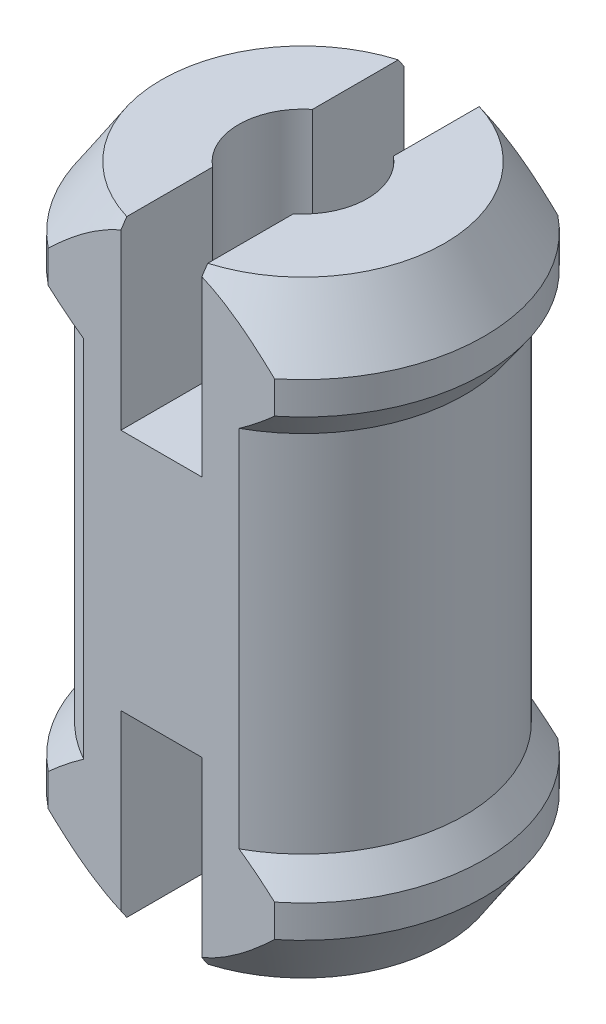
SolidWorks part; units mm, degrees
ref_plane "Front Plane" through (0, 0, 0) normal (0, 0, 1) x (1, 0, 0)
ref_plane "Top Plane" through (0, 0, 0) normal (0, 1, 0) x (1, 0, 0)
ref_plane "Right Plane" through (0, 0, 0) normal (1, 0, 0) x (0, 0, -1)
sketch "Sketch2" plane through (0, 0, 0) normal (1, 0, 0) x (0, 0, -1)
  line L0 (-17.036, 16) -> (-18.947, 16)
  line L1 (-18.947, 16) -> (-18.947, 11.5)
  line L2 (-18.947, 11.5) -> (-20.536, 11.5)
  line L3 (-20.536, 11.5) -> (-20.536, 8.5)
  line L4 (-20.536, 8.5) -> (-16.5442, 8.5)
  line L5 (-16.5442, 8.5) -> (-16.5442, 13)
  line L6 (-16.5442, 13) -> (-16.0559, 13.7)
  line L7 (-16.0559, 13.7) -> (-16.0559, 14.5)
  line L8 (-16.0559, 14.5) -> (-17.036, 16)
  dimension "D1" = 3.9917
  dimension "D2" = 1.911
  dimension "D3" = 4.5
  dimension "D4" = 4.5
  dimension "D5" = 0.8
  dimension "D6" = 1.5
  dimension "D7" = 0.7
  dimension "D8" = 4.4801
  dimension "D9" = 3.5
revolve "Revolve1" add sketch "Sketch2" angle 360 about L3
sketch "Sketch4" plane through (0, 16, 0) normal (0, 1, 0) x (1, 0, 0)
  line L0 (0, -14.676) -> (0, -33.3859) construction
  line L1 (-1, -14.676) -> (-1, -33.3859)
  line L2 (1, -14.676) -> (1, -33.3859)
  arc A0 (-1, -14.676) -> (1, -14.676) centre (0, -14.676) cw
  arc A1 (-1, -33.3859) -> (1, -33.3859) centre (0, -33.3859) ccw
  dimension "D1" = 1
  dimension "D2" = 1
extrude "Cut-Extrude2" cut sketch "Sketch4" against normal blind 4.5
sketch "Sketch5" plane through (0, 16, 0) normal (0, 1, 0) x (1, 0, 0)
  line L0 (0, -20.536) -> (-6.3318, -20.536) construction
  line L1 (0, -20.536) -> (7.4758, -20.536) construction
  line L2 (0, -17.036) -> (7.4758, -17.036)
  line L3 (0, -17.036) -> (-6.3318, -17.036)
  line L4 (0, -24.036) -> (7.4758, -24.036)
  line L5 (0, -24.036) -> (-6.3318, -24.036)
  line L6 (-1, -24.903) -> (-1, -23.8901) construction
  line L7 (-1, -17.1819) -> (-1, -16.169) construction
  line L8 (1, -16.169) -> (1, -17.1819) construction
  line L9 (1, -23.8901) -> (1, -24.903) construction
  line L10 (-1, -24.036) -> (-1, -23.8901)
  line L11 (-1, -17.1819) -> (-1, -17.036)
  line L12 (1, -17.036) -> (1, -17.1819)
  line L13 (1, -23.8901) -> (1, -24.036)
  line L15 (-6.3318, -17.036) -> (7.4758, -17.036)
  line L16 (-6.3318, -17.036) -> (-6.3318, -13.7773)
  line L17 (-6.3318, -13.7773) -> (7.4758, -13.7773)
  line L18 (7.4758, -17.036) -> (7.4758, -13.7773)
  line L19 (7.4758, -24.036) -> (-6.5355, -24.036)
  line L20 (7.4758, -24.036) -> (7.4758, -26.0597)
  line L21 (7.4758, -26.0597) -> (-6.5355, -26.0597)
  line L22 (-6.5355, -24.036) -> (-6.5355, -26.0597)
  arc A0 (7.4758, -17.036) -> (7.4758, -24.036) centre (7.4758, -20.536) cw
  arc A1 (-6.3318, -17.036) -> (-6.3318, -24.036) centre (-6.3318, -20.536) ccw
  arc A2 (-1, -16.169) -> (-1, -24.903) centre (0, -20.536) ccw construction
  arc A3 (-1, -17.1819) -> (-1, -23.8901) centre (0, -20.536) ccw construction
  arc A4 (1, -24.903) -> (1, -16.169) centre (0, -20.536) ccw construction
  arc A5 (1, -23.8901) -> (1, -17.1819) centre (0, -20.536) ccw construction
  arc A6 (-2.7966, -17.036) -> (-2.7966, -24.036) centre (0, -20.536) ccw
  arc A7 (-1, -17.1819) -> (-1, -23.8901) centre (0, -20.536) ccw
  arc A8 (2.7966, -24.036) -> (2.7966, -17.036) centre (0, -20.536) ccw
  arc A9 (1, -23.8901) -> (1, -17.1819) centre (0, -20.536) ccw
  dimension "D1" = 3.5
  dimension "D2" = 3.5
extrude "Cut-Extrude4" cut sketch "Sketch5" against normal through all contours L2 L15 L18 L17 L16 L3 | L19 L22 L21 L20 L4 L5 L11
mirror "Mirror4" about plane through (0, 8.5, 20.536) normal (0, 1, 0) of "Revolve1", "Cut-Extrude4"
sketch "Sketch7" plane through (0, 1, 0) normal (0, -1, 0) x (1, 0, 0)
  line L0 (0, 20.536) -> (0, 26.3334) construction
  line L1 (0, 26.3334) -> (0, 10.9386) construction
  line L2 (-1, 26.3334) -> (-1, 10.9386)
  line L3 (1, 26.3334) -> (1, 10.9386)
  arc A0 (-1, 26.3334) -> (1, 26.3334) centre (0, 26.3334) cw
  arc A1 (-1, 10.9386) -> (1, 10.9386) centre (0, 10.9386) ccw
  dimension "D1" = 1
  dimension "D2" = 1
extrude "Cut-Extrude5" cut sketch "Sketch7" against normal blind 4.5
